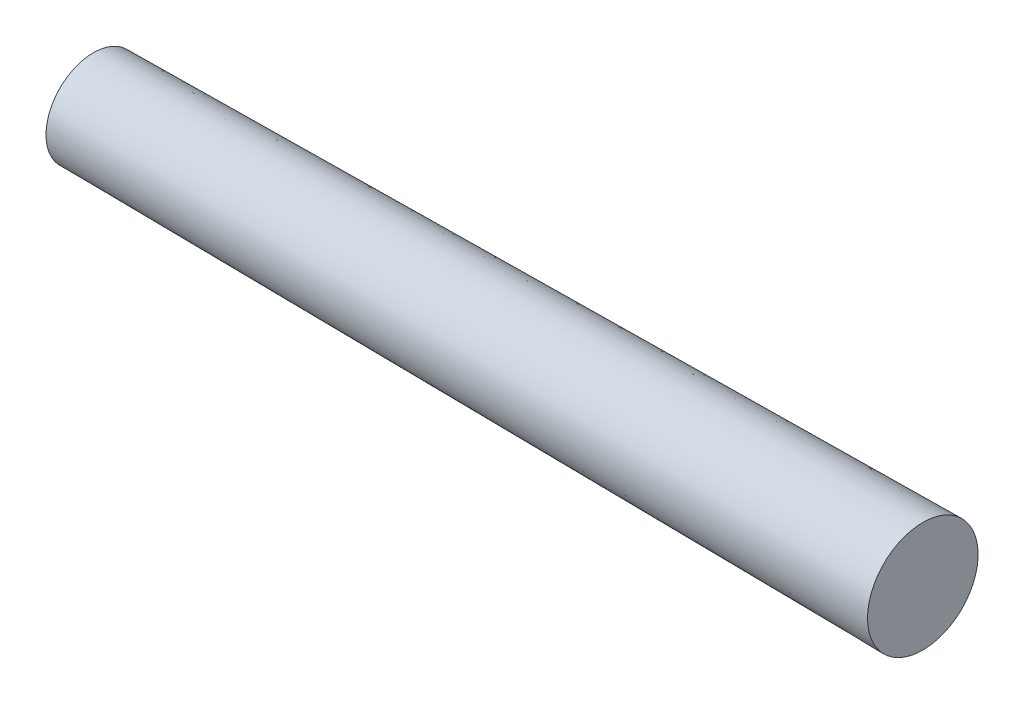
SolidWorks part; units mm, degrees
ref_plane "Front" through (0, 0, 0) normal (0, 0, 1) x (1, 0, 0)
ref_plane "Top" through (0, 0, 0) normal (0, 1, 0) x (1, 0, 0)
ref_plane "Right" through (0, 0, 0) normal (1, 0, 0) x (0, 0, -1)
sketch "Sketch1" plane through (0, 0, 0) normal (0, 0, 1) x (1, 0, 0)
  line L0 (-76.115, 0) -> (86.5878, 0) construction
  line L1 (52.5, 0) -> (52.5, 7)
  line L2 (52.5, 7) -> (-52.5, 6)
  line L3 (-52.5, 6) -> (-52.5, 0)
  line L4 (-52.5, 0) -> (52.5, 0)
  dimension "D1" = 14
  dimension "D2" = 105
  dimension "D3" = 12
revolve "Revolve1" add sketch "Sketch1" angle 360 about L0
